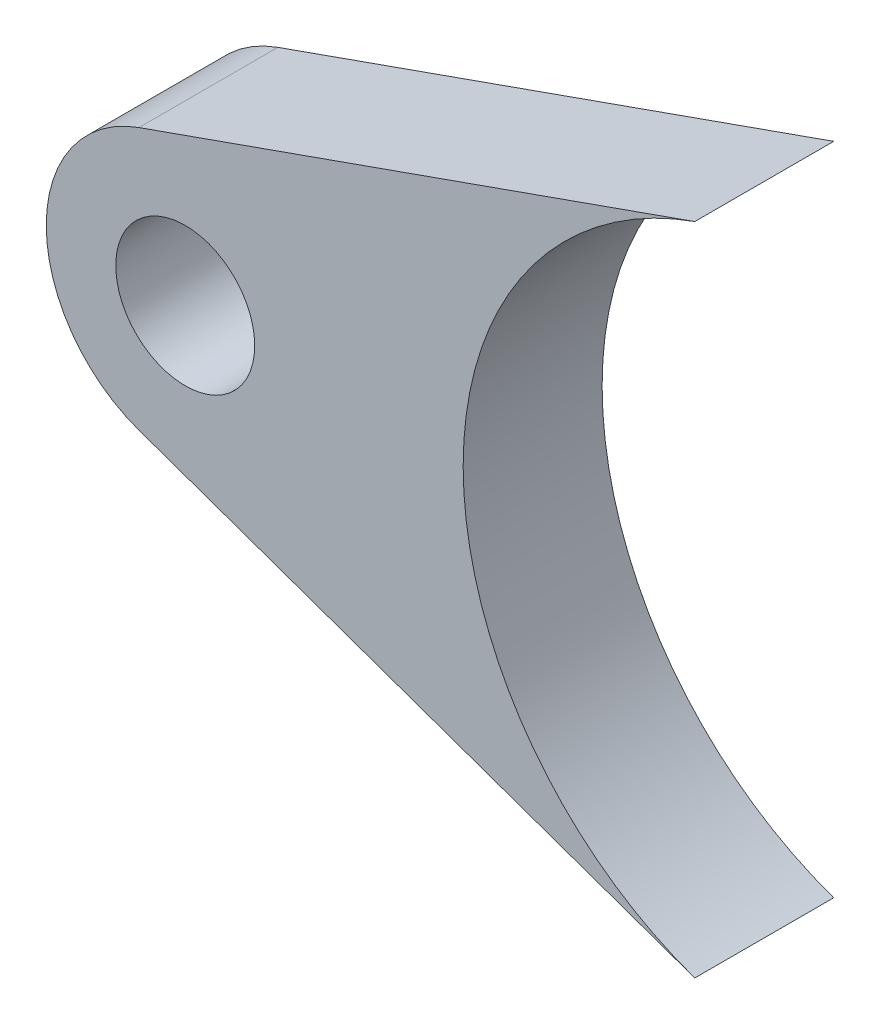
SolidWorks part; units mm, degrees
ref_plane "前视基准面" through (0, 0, 0) normal (0, 0, 1) x (1, 0, 0)
ref_plane "上视基准面" through (0, 0, 0) normal (0, 1, 0) x (1, 0, 0)
ref_plane "右视基准面" through (0, 0, 0) normal (1, 0, 0) x (0, 0, -1)
sketch "草图1" plane through (0, 0, 0) normal (0, 0, 1) x (1, 0, 0)
  line L0 (-16.6667, 47.1405) -> (-96.6667, 18.8562)
  line L1 (-96.6667, -18.8562) -> (-16.6667, -47.1405)
  line L2 (0, 0) -> (126.854, 0) construction
  arc A0 (-16.6667, 47.1405) -> (-16.6667, -47.1405) centre (0, 0) ccw
  arc A1 (-96.6667, 18.8562) -> (-96.6667, -18.8562) centre (-90, 0) ccw
  circle A2 centre (-90, 0) radius 10
  dimension "D1" = 100
  dimension "D3" = 20
  dimension "D4" = 20
  dimension "D2" = 90
extrude "拉伸1" add sketch "草图1" along normal blind 20
